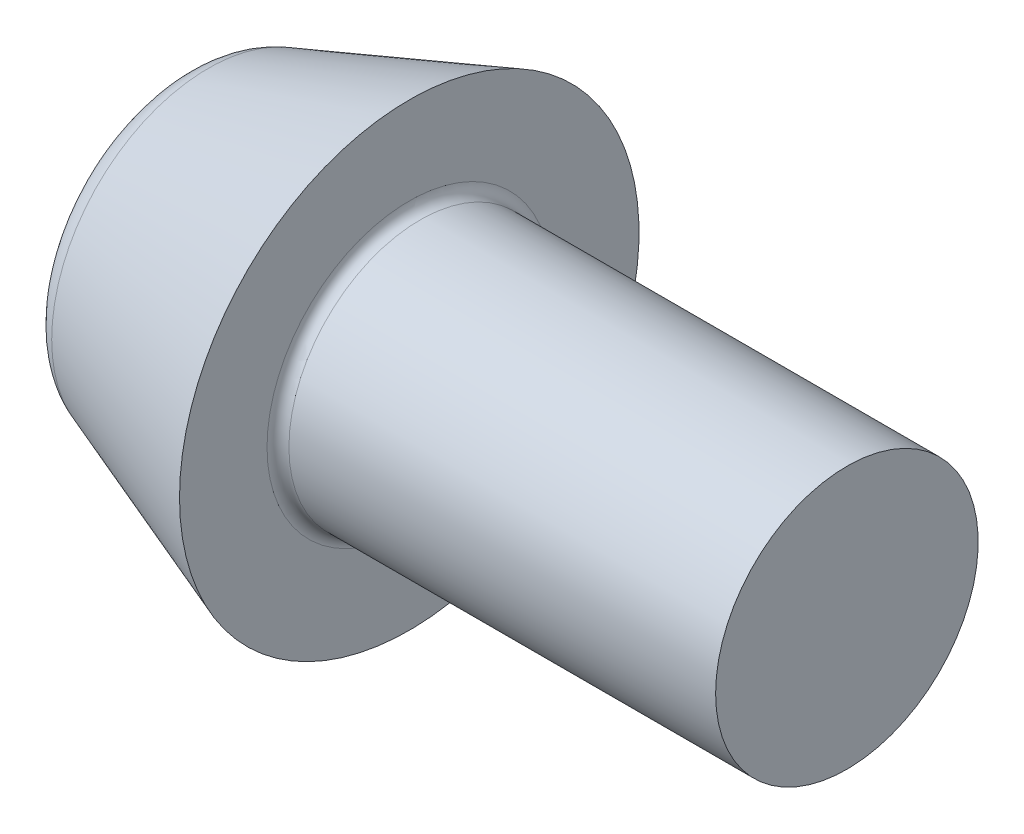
SolidWorks part; units mm, degrees
ref_plane "Front" through (0, 0, 0) normal (0, 0, 1) x (1, 0, 0)
ref_plane "Top" through (0, 0, 0) normal (0, 1, 0) x (1, 0, 0)
ref_plane "Right" through (0, 0, 0) normal (1, 0, 0) x (0, 0, -1)
other "Configuration Table"
sketch "Sketch1" plane through (0, 0, 0) normal (0, 0, 1) x (1, 0, 0)
  line L0 (0, 0) -> (30.5, 0)
  line L1 (30.5, 0) -> (30.5, 6)
  line L2 (30.5, 6) -> (10.5, 6)
  line L3 (10.5, 6) -> (10.5, 10.5)
  line L4 (10.5, 10.5) -> (0, 6.6783)
  line L5 (0, 6.6783) -> (0, 0)
  line L6 (-26.4886, 0) -> (67.8543, 0) construction
  line L7 (-6.0327, 10.5) -> (19.105, 10.5) construction
  dimension "D1" = 20
  dimension "L" = 20
  dimension "d" = 12
  dimension "K" = 10.5
  dimension "dk" = 21
revolve "Base-Revolve" add sketch "Sketch1" angle 360 about L6
fillet "Fillet1" radius 0.5 1 edges at (10.5, 0, 6)
fillet "Fillet2" radius 2 1 edges at (0, 0, 6.6783)
